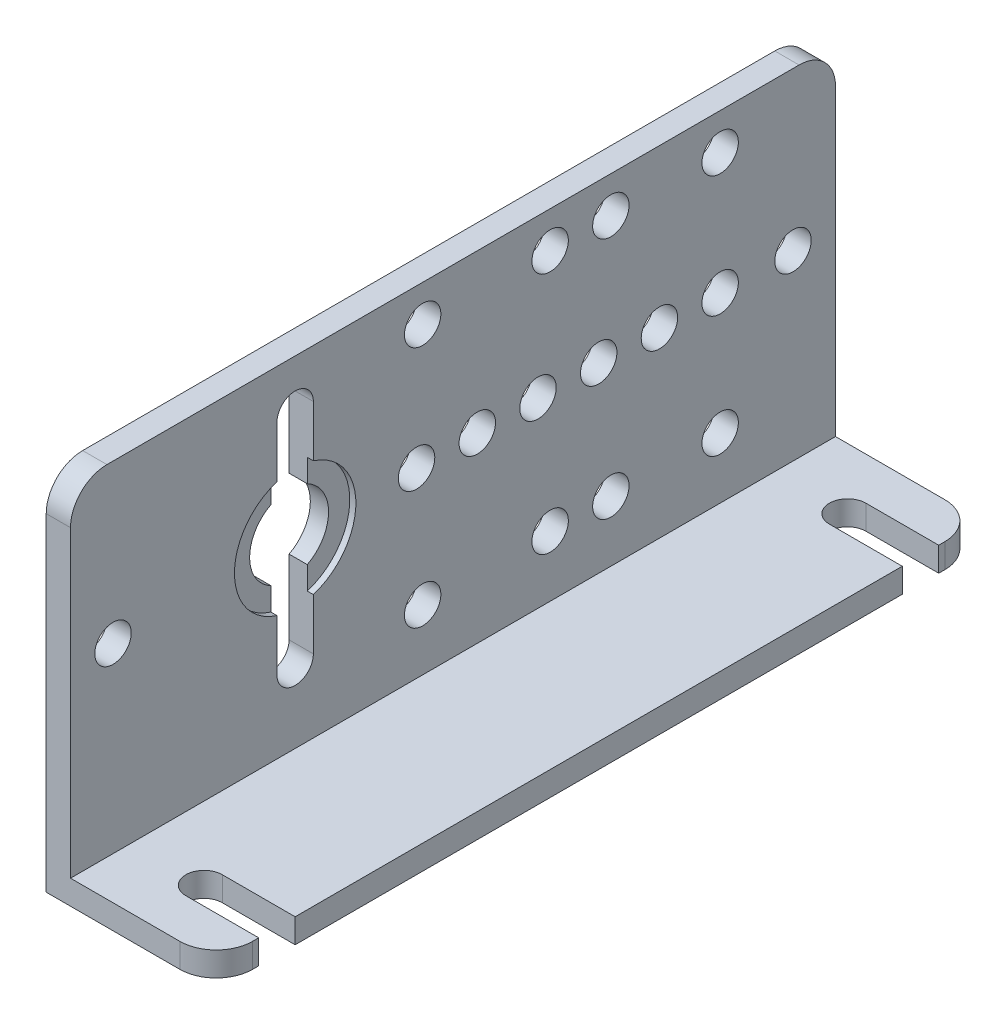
SolidWorks part; units mm, degrees
ref_plane "Plan de face" through (0, 0, 0) normal (0, 0, 1) x (1, 0, 0)
ref_plane "Plan de dessus" through (0, 0, 0) normal (0, 1, 0) x (1, 0, 0)
ref_plane "Plan de droite" through (0, 0, 0) normal (1, 0, 0) x (0, 0, -1)
sketch "Esquisse1" plane through (0, 0, 0) normal (0, 0, 1) x (1, 0, 0)
  line L0 (0, 0) -> (14, 0)
  line L1 (14, 0) -> (14, 2)
  line L2 (14, 2) -> (2, 2)
  line L3 (2, 2) -> (2, 30)
  line L4 (2, 30) -> (0, 30)
  line L5 (0, 30) -> (0, 0)
  dimension "D1" = 14
  dimension "D2" = 30
  dimension "D3" = 2
  dimension "D4" = 2
extrude "Extrusion1" add sketch "Esquisse1" along normal blind 63
fillet "Congé1" radius 3 4 edges at (14, 1, 63) (1, 30, 63) (1, 30, 0) (14, 1, 0)
sketch "Esquisse2" plane through (0, 0, 0) normal (0, -1, 0) x (1, 0, 0)
  line L0 (8, 65.6532) -> (8, -5.7581) construction
  line L1 (14, 60) -> (14, 3) construction
  line L2 (0, 0) -> (11, 0) construction
  line L3 (14, 3.5) -> (8, 3.5)
  line L4 (14, 3.5) -> (14, 6.5)
  line L5 (14, 6.5) -> (8, 6.5)
  arc A0 (8, 6.5) -> (8, 3.5) centre (8, 5) ccw
  dimension "D1" = 6
  dimension "D2" = 3
  dimension "D3" = 3.5
extrude "Enlèv. mat.-Extru.1" cut sketch "Esquisse2" against normal through all
pattern_linear "Répétition linéaire1" count 2 spacing 53 along (0, 0, 1) of "Enlèv. mat.-Extru.1"
sketch "Esquisse3" plane through (0, 0, 0) normal (-1, 0, 0) x (0, 0, 1)
  line L0 (0, 27) -> (0, 0) construction
  line L1 (60, 30) -> (3, 30) construction
  circle A0 centre (3.5, 17) radius 1.5
  dimension "D3" = 3
  dimension "D1" = 3.5
  dimension "D2" = 13
extrude "Enlèv. mat.-Extru.2" cut sketch "Esquisse3" against normal through all
pattern_linear "Répétition linéaire2" count 2 spacing 56 along (0, 0, 1) of "Enlèv. mat.-Extru.2"
sketch "Esquisse4" plane through (0, 0, 0) normal (-1, 0, 0) x (0, 0, 1)
  line L0 (60, 30) -> (3, 30) construction
  line L1 (0, 27) -> (0, 0) construction
  circle A0 centre (9.5, 17) radius 1.5
  dimension "D3" = 3
  dimension "D1" = 13
  dimension "D2" = 9.5
extrude "Enlèv. mat.-Extru.3" cut sketch "Esquisse4" against normal through all
pattern_linear "Répétition linéaire3" count 6 spacing 5 along (0, 0, 1) of "Enlèv. mat.-Extru.3"
sketch "Esquisse5" plane through (0, 0, 0) normal (-1, 0, 0) x (0, 0, 1)
  line L0 (0, 27) -> (0, 0) construction
  line L1 (60, 30) -> (3, 30) construction
  line L3 (60, 30) -> (3, 30) construction
  circle A0 centre (9.5, 27) radius 1.5
  circle A1 centre (18.5, 27) radius 1.5
  circle A2 centre (23.5, 27) radius 1.5
  circle A3 centre (34, 27) radius 1.5
  dimension "D2" = 3
  dimension "D1" = 9.5
  dimension "D3" = 3
  dimension "D4" = 18.5
  dimension "D5" = 5
  dimension "D6" = 10.5
  dimension "D7" = 3
extrude "Enlèv. mat.-Extru.4" cut sketch "Esquisse5" against normal through all
pattern_linear "Répétition linéaire4" count 2 spacing 20 along (0, -1, 0) of "Enlèv. mat.-Extru.4"
sketch "Esquisse6" plane through (0, 0, 0) normal (-1, 0, 0) x (0, 0, 1)
  line L0 (44.5, 30) -> (44.5, 0) construction
  line L1 (60, 30) -> (3, 30) construction
  line L2 (63, 0) -> (0, 0) construction
  line L3 (37.1168, 17) -> (57.2239, 17) construction
  line L4 (63, 27) -> (63, 0) construction
  line L5 (43, 14.1169) -> (43, 8)
  line L6 (46, 14.1169) -> (46, 8)
  line L7 (43, 26) -> (43, 19.8831)
  line L8 (60, 30) -> (3, 30) construction
  line L9 (46, 26) -> (46, 19.8831)
  arc A0 (43, 19.8831) -> (43, 14.1169) centre (44.5, 17) ccw
  arc A1 (43, 26) -> (46, 26) centre (44.5, 26) cw
  arc A2 (43, 8) -> (46, 8) centre (44.5, 8) ccw
  arc A3 (46, 14.1169) -> (46, 19.8831) centre (44.5, 17) ccw
  dimension "D5" = 6.5
  dimension "D1" = 18.5
  dimension "D2" = 13
  dimension "D3" = 18
  dimension "D4" = 3
  dimension "D6" = 4
extrude "Enlèv. mat.-Extru.5" cut sketch "Esquisse6" against normal through all
sketch "Esquisse7" plane through (2, 0, 0) normal (1, 0, 0) x (0, 0, -1)
  circle A0 centre (-44.5, 17) radius 5
  arc A1 (-43, 14.1169) -> (-43, 19.8831) centre (-44.5, 17) ccw construction
  dimension "D1" = 10
extrude "Enlèv. mat.-Extru.6" cut sketch "Esquisse7" against normal blind 0.5
